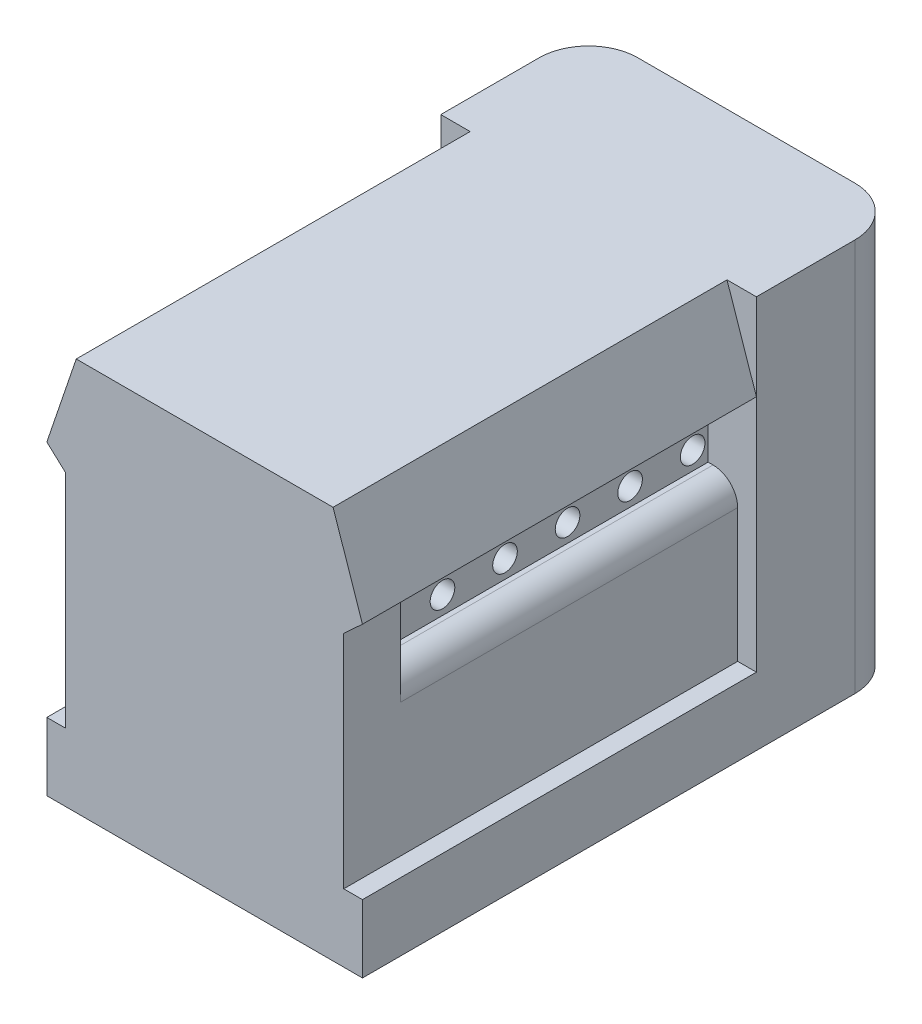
SolidWorks part; units mm, degrees
ref_plane "Plan de face" through (0, 0, 0) normal (0, 0, 1) x (1, 0, 0)
ref_plane "Plan de dessus" through (0, 0, 0) normal (0, 1, 0) x (1, 0, 0)
ref_plane "Plan de droite" through (0, 0, 0) normal (1, 0, 0) x (0, 0, -1)
sketch "Esquisse1" plane through (0, 0, 0) normal (0, 0, 1) x (1, 0, 0)
  line L0 (0, 0) -> (0, 63.4039) construction
  line L1 (-4.4493, 10.641) -> (-4.4493, 9.1647)
  line L2 (-6.41, 0) -> (-6.41, 2.7566)
  line L3 (-6.41, 2.7566) -> (-5.6493, 2.7566)
  line L4 (-4.4493, 9.1647) -> (-4.6493, 9.1647)
  line L5 (-4.4493, 10.641) -> (-6.41, 12.4442)
  line L6 (-6.41, 12.4442) -> (-5.2156, 15.9609)
  line L7 (-5.6493, 8.1647) -> (-5.6493, 2.7566)
  line L8 (-5.2156, 15.9609) -> (5.2156, 15.9609)
  line L9 (0, 0) -> (-6.41, 0)
  line L10 (5.6493, 8.1647) -> (5.6493, 2.7566)
  line L11 (6.41, 12.4442) -> (5.2156, 15.9609)
  line L12 (4.4493, 10.641) -> (6.41, 12.4442)
  line L13 (4.4493, 9.1647) -> (4.6493, 9.1647)
  line L14 (6.41, 2.7566) -> (5.6493, 2.7566)
  line L15 (6.41, 0) -> (6.41, 2.7566)
  line L16 (4.4493, 10.641) -> (4.4493, 9.1647)
  line L17 (0, 0) -> (6.41, 0)
  arc A0 (-4.6493, 9.1647) -> (-5.6493, 8.1647) centre (-4.6493, 8.1647) ccw
  arc A1 (4.6493, 9.1647) -> (5.6493, 8.1647) centre (4.6493, 8.1647) cw
  point P14 (-5.6493, 9.1647)
  point P20 (0, 15.9609)
  dimension "D2" = 1
  dimension "D1" = 1.2
  dimension "D3" = 0.7607
  dimension "D4" = 5.4081
  dimension "D5" = 1.4763
  dimension "D6" = 1.8032
  dimension "D7" = 132.604
  dimension "D8" = 3.714
  dimension "D9" = 113.845
  dimension "D10" = 6.41
extrude "Extrusion1" add sketch "Esquisse1" along normal blind 16
ref_plane "Plan1" through (6.41, 0, 0) normal (1, 0, 0) x (0, 0, -1)
sketch "Esquisse2" plane through (0, 15.9609, 0) normal (0, 1, 0) x (1, 0, 0)
  line L0 (0, 0) -> (0, 6.3868) construction
  line L1 (5.2156, 0) -> (-5.2156, 0) construction
  line L2 (6.41, -7.9805) -> (6.41, 7.9805) construction
  line L4 (-6.41, 0) -> (6.41, 0)
  line L5 (-6.41, 0) -> (-6.41, 4)
  line L6 (-4.41, 6) -> (4.41, 6)
  line L7 (6.41, 0) -> (6.41, 4)
  arc A0 (4.41, 6) -> (6.41, 4) centre (4.41, 4) cw
  arc A1 (-4.41, 6) -> (-6.41, 4) centre (-4.41, 4) ccw
  point P15 (0, 6)
  dimension "D2" = 2
  dimension "D1" = 6
extrude "Boss.-Extru.1" add sketch "Esquisse2" against normal up to surface (15.9609 mm away)
sketch "Esquisse3" plane through (-4.4493, 0, 0) normal (-1, 0, 0) x (0, 0, 1)
  line L1 (-6, 0) -> (-6, 15.9609) construction
  circle A0 centre (0.63, 9.9028) radius 0.5
  dimension "D1" = 1
  dimension "D3" = 6.63
extrude "Enlèv. mat.-Extru.1" cut sketch "Esquisse3" against normal up to next
pattern_linear "Répétition linéaire1" count 5 spacing 2.54 along (0, 0, 1) of "Enlèv. mat.-Extru.1"
sketch "Esquisse4" plane through (0, 0, 0) normal (0, -1, 0) x (1, 0, 0)
  line L0 (-6.41, 16) -> (6.41, 16) construction
  line L1 (-5.3951, 16) -> (5.0141, 16)
  line L2 (-5.3951, 16) -> (-5.3951, 13.7)
  line L3 (-5.3951, 13.7) -> (5.0141, 13.7)
  line L4 (5.0141, 16) -> (5.0141, 13.7)
  dimension "D1" = 2.3
extrude "Boss.-Extru.2" add sketch "Esquisse4" against normal blind 13
sketch "Esquisse5" plane through (0, 0, 16) normal (0, 0, 1) x (1, 0, 0)
  line L0 (-5.6493, 2.7566) -> (-5.6493, 0) construction
  line L1 (-6.41, 0) -> (6.41, 0) construction
  line L2 (5.6493, 2.7566) -> (5.6493, 0) construction
sketch "Esquisse7" plane through (0, 0, 0) normal (0, -1, 0) x (1, 0, 0)
  line L1 (-5.6493, 16) -> (5.6493, 16)
  line L2 (-5.6493, 16) -> (-5.6493, 13.7)
  line L3 (-5.6493, 13.7) -> (5.6493, 13.7)
  line L4 (5.6493, 16) -> (5.6493, 13.7)
  dimension "D1" = 2.3
extrude "Boss.-Extru.3" add sketch "Esquisse7" against normal blind 13
sketch "Esquisse8" plane through (0, 0, 0) normal (0, -1, 0) x (1, 0, 0)
  line L0 (-5.1597, -4.45) -> (5.1444, -4.45) construction
  line L1 (-4.41, -6) -> (4.41, -6) construction
  line L2 (0, -6) -> (0, -2.0663) construction
  circle A0 centre (-0.0076, -4.45) radius 0.4
  circle A1 centre (-2.5476, -4.45) radius 0.4
  circle A2 centre (2.5476, -4.45) radius 0.4
  dimension "D2" = 0.8
  dimension "D3" = 0.8
  dimension "D1" = 1.55
  dimension "D4" = 2.54
extrude "Boss.-Extru.4" add sketch "Esquisse8" along normal blind 3
